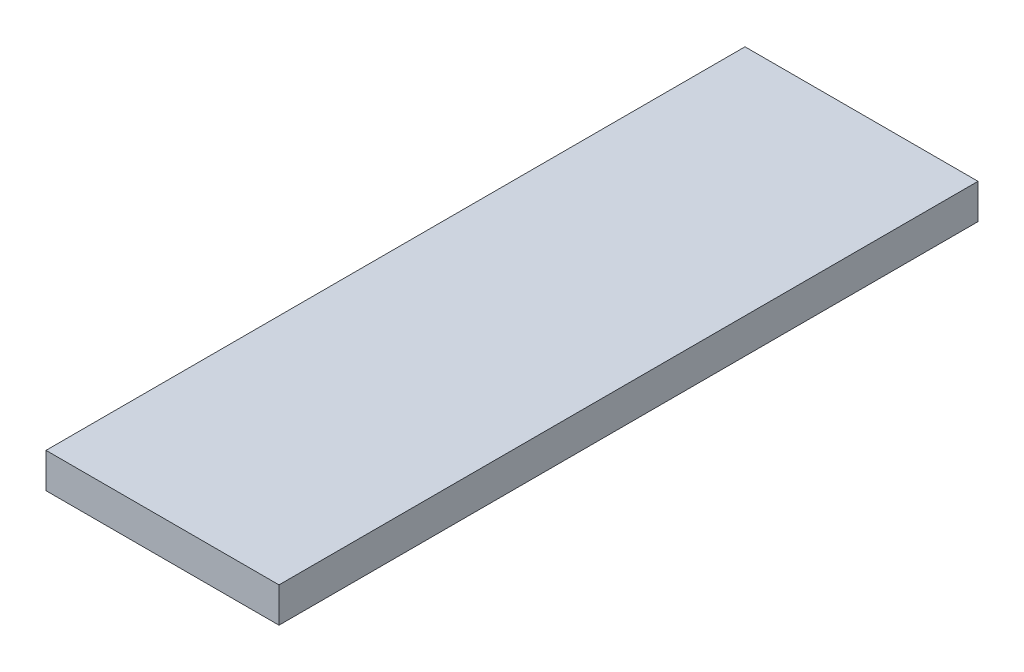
SolidWorks part; units mm, degrees
ref_plane "Front Plane" through (0, 0, 0) normal (0, 0, 1) x (1, 0, 0)
ref_plane "Top Plane" through (0, 0, 0) normal (0, 1, 0) x (1, 0, 0)
ref_plane "Right Plane" through (0, 0, 0) normal (1, 0, 0) x (0, 0, -1)
sketch "Sketch1" plane through (0, 0, 0) normal (0, 1, 0) x (1, 0, 0)
  line L1 (0, 0) -> (40, 0)
  line L2 (0, 0) -> (0, 120)
  line L3 (0, 120) -> (40, 120)
  line L4 (40, 0) -> (40, 120)
extrude "Boss-Extrude1" add sketch "Sketch1" along normal blind 6
